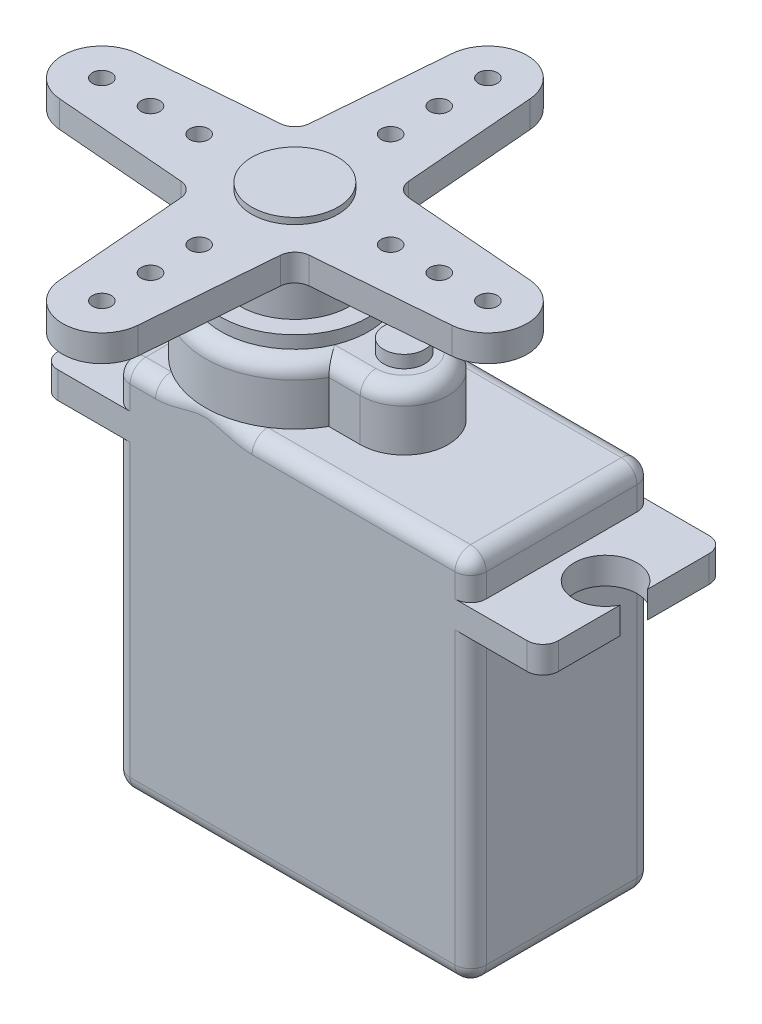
SolidWorks part; units mm, degrees
ref_plane "Спереди" through (0, 0, 0) normal (0, 0, 1) x (1, 0, 0)
ref_plane "Сверху" through (0, 0, 0) normal (0, 1, 0) x (1, 0, 0)
ref_plane "Справа" through (0, 0, 0) normal (1, 0, 0) x (0, 0, -1)
sketch "Эскиз1" plane through (0, 0, 0) normal (0, 1, 0) x (1, 0, 0)
  line L1 (0, 5.8) -> (22.7, 5.8)
  line L2 (0, 5.8) -> (0, -5.8)
  line L3 (0, -5.8) -> (22.7, -5.8)
  line L4 (22.7, 5.8) -> (22.7, -5.8)
  dimension "D1" = 22.7
  dimension "D2" = 11.6
extrude "Бобышка-Вытянуть1" add sketch "Эскиз1" along normal blind 19.5
sketch "Эскиз2" plane through (0, 19.5, 0) normal (0, 1, 0) x (1, 0, 0)
  line L0 (-4.6, 5.8) -> (27.3, 5.8)
  line L1 (27.3, 5.8) -> (27.3, -5.8)
  line L2 (27.3, -5.8) -> (-4.6, -5.8)
  line L3 (-4.6, -5.8) -> (-4.6, 5.8)
  line L4 (22.7, -5.8) -> (22.7, 5.8) construction
  line L5 (0, 5.8) -> (0, -5.8) construction
  dimension "D1" = 4.6
  dimension "D2" = 4.6
extrude "Бобышка-Вытянуть2" add sketch "Эскиз2" along normal blind 1.7
sketch "Эскиз3" plane through (0, 21.2, 0) normal (0, 1, 0) x (1, 0, 0)
  line L0 (0, 5.8) -> (22.7, 5.8)
  line L1 (27.3, 5.8) -> (-4.6, 5.8) construction
  line L2 (22.7, 5.8) -> (22.7, -5.8)
  line L3 (-4.6, -5.8) -> (27.3, -5.8) construction
  line L4 (22.7, -5.8) -> (0, -5.8)
  line L5 (0, -5.8) -> (0, 5.8)
extrude "Бобышка-Вытянуть3" add sketch "Эскиз3" along normal blind 2.5
sketch "Эскиз4" plane through (0, 23.7, 0) normal (0, 1, 0) x (1, 0, 0)
  line L0 (0, 0) -> (22.7, 0) construction
  line L1 (22.7, -5.8) -> (22.7, 5.8) construction
  line L2 (10.6649, 2.8) -> (10.6649, -2.8) construction
  line L3 (10.6649, 2.8) -> (12.6649, 2.8)
  line L4 (12.6649, 2.8) -> (12.6649, -2.8) construction
  line L5 (12.6649, -2.8) -> (10.6649, -2.8)
  line L6 (0, 5.8) -> (0, -5.8) construction
  arc A0 (10.6649, 2.8) -> (10.6649, -2.8) centre (5.7, 0) ccw
  arc A1 (12.6649, -2.8) -> (12.6649, 2.8) centre (12.6649, 0) ccw
  dimension "D1" = 5.7
  dimension "D2" = 5.7
  dimension "D3" = 5.6
  dimension "D4" = 2
extrude "Бобышка-Вытянуть4" add sketch "Эскиз4" along normal blind 3.7
sketch "Эскиз5" plane through (0, 27.4, 0) normal (0, 1, 0) x (1, 0, 0)
  circle A0 centre (5.7, 0) radius 4.7
  circle A1 centre (12.6649, 0) radius 1.3
  dimension "D1" = 2.6
  dimension "D2" = 9.4
extrude "Бобышка-Вытянуть5" add sketch "Эскиз5" along normal blind 0.8
sketch "Эскиз6" plane through (0, 21.2, 0) normal (0, 1, 0) x (1, 0, 0)
  line L0 (-4.6, 0) -> (27.3, 0) construction
  line L1 (-4.6, 5.8) -> (-4.6, -5.8) construction
  line L2 (27.3, -5.8) -> (27.3, 5.8) construction
  circle A0 centre (-2.8, 0) radius 2
  circle A1 centre (25.5, 0) radius 2
  dimension "D1" = 4
  dimension "D2" = 4
  dimension "D3" = 1.8
  dimension "D4" = 31.9
  dimension "D5" = 1.8
extrude "Вырез-Вытянуть1" cut sketch "Эскиз6" against normal up to next
fillet "Скругление1" radius 1 12 edges at (-4.6, 20.35, 5.8) (-4.6, 20.35, -5.8) (27.3, 20.35, -5.8) (27.3, 20.35, 5.8)
fillet "Скругление2" radius 1 4 edges at (11.6649, 27.4, 2.8) (15.4649, 27.4, 0) (11.6649, 27.4, -2.8) (0, 27.4, 0)
fillet "Скругление3" radius 1 17 edges at (0.2929, 0, 5.5071) (0, 0, 0) (0.2929, 0, -5.5071) (11.35, 0, -5.8) (22.4071, 0, -5.5071) (22.7, 0, 0) (22.4071, 0, 5.5071) (0.2929, 23.7, 5.5071) (0, 23.7, 2.4) (0, 23.7, -2.4) (0.2929, 23.7, -5.5071) (11.35, 23.7, -5.8) (22.4071, 23.7, -5.5071) (22.7, 23.7, 0) (22.4071, 23.7, 5.5071) (11.35, 0, 5.8) (11.35, 23.7, 5.8)
sketch "Эскиз7" plane through (0, 28.2, 0) normal (0, 1, 0) x (1, 0, 0)
  circle A0 centre (5.7, 0) radius 3.5
  dimension "D1" = 7
extrude "Бобышка-Вытянуть6" add sketch "Эскиз7" along normal blind 3 separate body
sketch "Эскиз8" plane through (0, 31.2, 0) normal (0, 1, 0) x (1, 0, 0)
  line L0 (-6.6, 0) -> (18, 0) construction
  line L1 (5.7, -3.5) -> (5.7, 3.5) construction
  line L2 (5.7, 3.5) -> (-6.801, 2.4919) construction
  line L3 (5.7, -3.5) -> (-6.801, -2.4919) construction
  line L4 (5.7, 3.5) -> (18.201, 2.4919) construction
  line L5 (5.7, -3.5) -> (18.201, -2.4919) construction
  line L6 (5.7, 3.5) -> (5.7, 12.3) construction
  line L7 (5.7, -3.5) -> (5.7, -12.3) construction
  line L8 (9.2, 0) -> (8.1919, -12.501) construction
  line L9 (2.2, 0) -> (3.2081, -12.501) construction
  line L10 (2.2, 0) -> (3.2081, 12.501) construction
  line L11 (9.2, 0) -> (8.1919, 12.501) construction
  line L12 (3.2081, 12.501) -> (2.5296, 4.0868)
  line L13 (1.6132, 3.1704) -> (-6.801, 2.4919)
  line L14 (8.1919, 12.501) -> (8.8704, 4.0868)
  line L15 (9.7868, 3.1704) -> (18.201, 2.4919)
  line L16 (18.201, -2.4919) -> (9.7868, -3.1704)
  line L17 (8.8704, -4.0868) -> (8.1919, -12.501)
  line L18 (3.2081, -12.501) -> (2.5296, -4.0868)
  line L19 (1.6132, -3.1704) -> (-6.801, -2.4919)
  circle A0 centre (5.7, 0) radius 3.5 construction
  arc A1 (18.201, 2.4919) -> (18.201, -2.4919) centre (18, 0) cw
  arc A2 (-6.801, 2.4919) -> (-6.801, -2.4919) centre (-6.6, 0) ccw
  circle A3 centre (18, 0) radius 0.6
  circle A4 centre (14.9, 0) radius 0.6
  circle A5 centre (11.8, 0) radius 0.6
  circle A6 centre (-6.6, 0) radius 0.6
  circle A7 centre (-3.5, 0) radius 0.6
  circle A8 centre (-0.4, 0) radius 0.6
  arc A9 (3.2081, 12.501) -> (8.1919, 12.501) centre (5.7, 12.3) cw
  arc A10 (8.1919, -12.501) -> (3.2081, -12.501) centre (5.7, -12.3) cw
  circle A11 centre (5.7, -12.3) radius 0.6
  circle A12 centre (5.7, -9.2) radius 0.6
  circle A13 centre (5.7, -6.1) radius 0.6
  circle A14 centre (5.7, 12.3) radius 0.6
  circle A15 centre (5.7, 9.2) radius 0.6
  circle A16 centre (5.7, 6.1) radius 0.6
  arc A17 (1.6132, 3.1704) -> (2.5296, 4.0868) centre (1.5328, 4.1672) ccw
  arc A18 (8.8704, 4.0868) -> (9.7868, 3.1704) centre (9.8672, 4.1672) ccw
  arc A19 (9.7868, -3.1704) -> (8.8704, -4.0868) centre (9.8672, -4.1672) ccw
  arc A20 (2.5296, -4.0868) -> (1.6132, -3.1704) centre (1.5328, -4.1672) ccw
  point P46 (2.4612, 3.2388)
  point P49 (8.9388, 3.2388)
  point P52 (8.9388, -3.2388)
  point P55 (2.4612, -3.2388)
  dimension "D3" = 2.5
  dimension "D4" = 2.5
  dimension "D5" = 1.2
  dimension "D6" = 1.2
  dimension "D7" = 1.2
  dimension "D8" = 1.2
  dimension "D9" = 1.2
  dimension "D10" = 1.2
  dimension "D15" = 2.5
  dimension "D16" = 2.5
  dimension "D19" = 1.2
  dimension "D20" = 1.2
  dimension "D21" = 1.2
  dimension "D22" = 1.2
  dimension "D23" = 1.2
  dimension "D24" = 1.2
  dimension "D29" = 1
  dimension "D1" = 12.3
  dimension "D2" = 12.3
  dimension "D11" = 3.1
  dimension "D12" = 3.1
  dimension "D13" = 3.1
  dimension "D14" = 3.1
  dimension "D17" = 12.3
  dimension "D18" = 12.3
  dimension "D25" = 3.1
  dimension "D26" = 3.1
  dimension "D27" = 3.1
  dimension "D28" = 3.1
extrude "Бобышка-Вытянуть7" add sketch "Эскиз8" along normal blind 1.7
sketch "Эскиз9" plane through (0, 32.9, 0) normal (0, 1, 0) x (1, 0, 0)
  circle A1 centre (5.7, 0) radius 2.75
  dimension "D1" = 5.5
extrude "Бобышка-Вытянуть8" add sketch "Эскиз9" along normal blind 0.4
